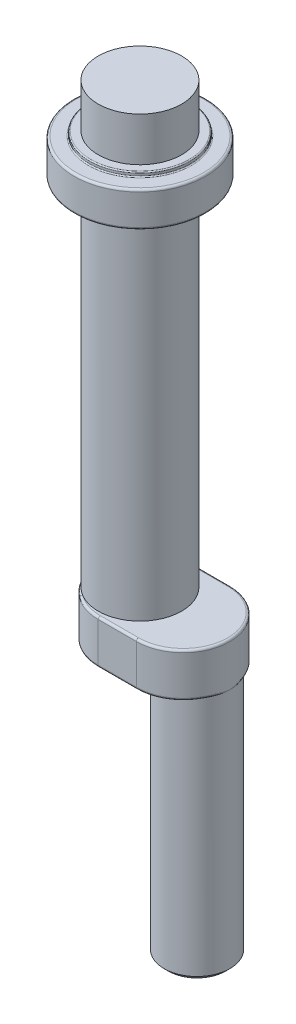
SolidWorks part; units mm, degrees
other "<Hinge Rod_01>-<Revolve1>"
other "<Hinge Rod_01>-<Chamfer1>"
ref_plane "Front Plane" through (0, 0, 0) normal (0, 0, 1) x (1, 0, 0)
ref_plane "Top Plane" through (0, 0, 0) normal (0, 1, 0) x (1, 0, 0)
ref_plane "Right Plane" through (0, 0, 0) normal (1, 0, 0) x (0, 0, -1)
mirrored part "Hinge Rod_01_Mirrored"
